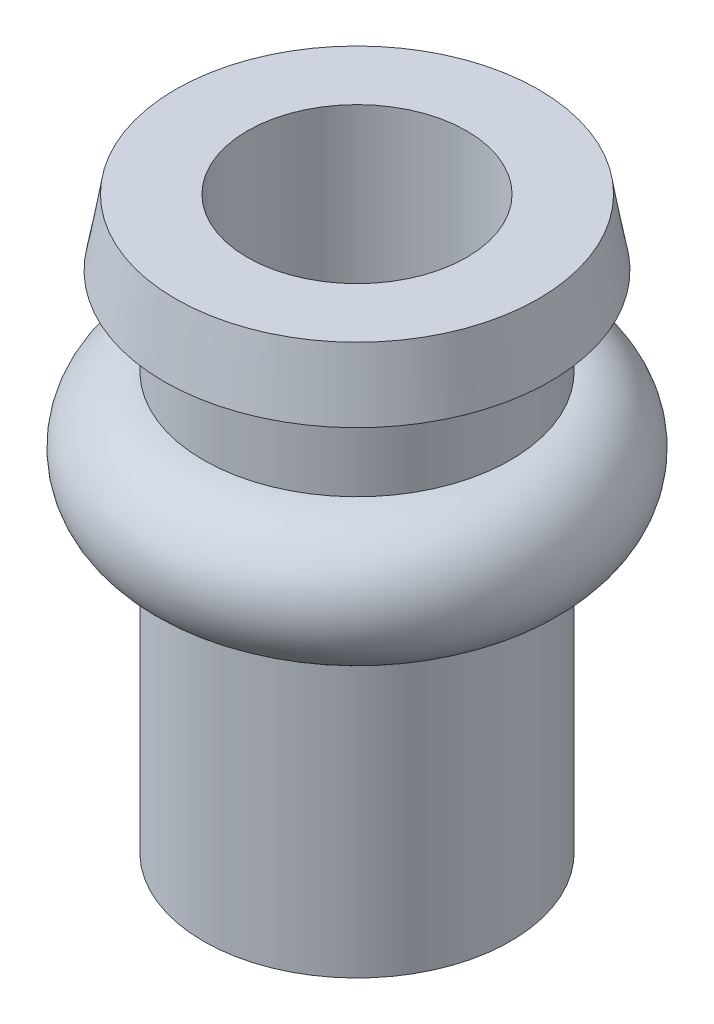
SolidWorks part; units mm, degrees
ref_plane "Vorne" through (0, 0, 0) normal (0, 0, 1) x (1, 0, 0)
ref_plane "Oben" through (0, 0, 0) normal (0, 1, 0) x (1, 0, 0)
ref_plane "Rechts" through (0, 0, 0) normal (1, 0, 0) x (0, 0, -1)
sketch "Skizze1" plane through (0, 0, 0) normal (0, 0, 1) x (1, 0, 0)
  line L0 (0, 38.9535) -> (0, -37.5523) construction
  line L1 (4.1355, 13) -> (0, 13)
  line L2 (3.5, 0) -> (3.5, 6.5)
  line L3 (3.5, 9.5) -> (3.5, 11.5)
  line L4 (3.5, 11.5) -> (4.4, 11.5)
  line L5 (4.4, 11.5) -> (4.1355, 13)
  line L6 (3.5, 0) -> (0, 0)
  line L7 (0, 13) -> (0, 0)
  arc A0 (3.5, 9.5) -> (3.5, 6.5) centre (3.5, 8) cw
  dimension "D2" = 1.5
  dimension "D1" = 10
  dimension "D3" = 1.5
  dimension "D4" = 3.5
  dimension "D5" = 4.4
  dimension "D6" = 3.5
  dimension "D7" = 13
revolve "Basis-Rotation" add sketch "Skizze1" angle 360 about L0
sketch "Skizze2" plane through (0, 0, 0) normal (0, -1, 0) x (1, 0, 0)
  circle A0 centre (0, 0) radius 2.5
  dimension "D1" = 5
extrude "Schnitt-Linear austragen2" cut sketch "Skizze2" against normal through all
